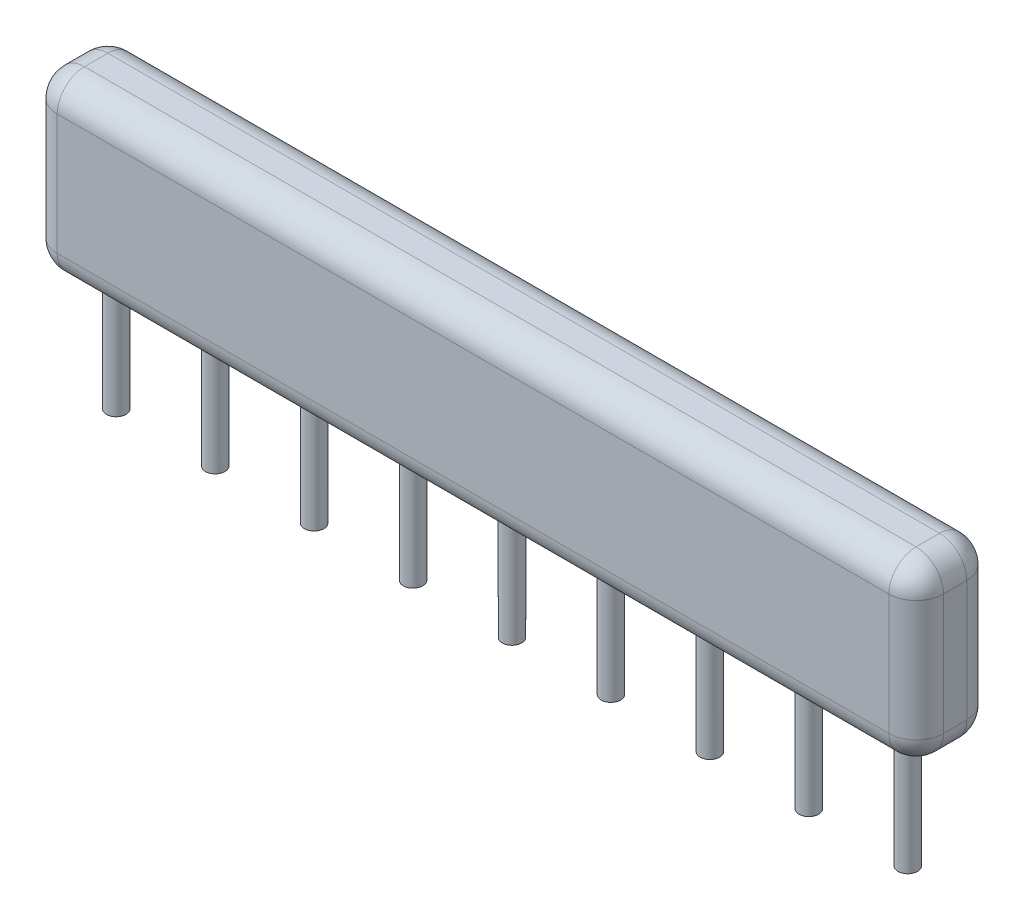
SolidWorks part; units mm, degrees
ref_plane "Plan de face" through (0, 0, 0) normal (0, 0, 1) x (1, 0, 0)
ref_plane "Plan de dessus" through (0, 0, 0) normal (0, 1, 0) x (1, 0, 0)
ref_plane "Plan de droite" through (0, 0, 0) normal (1, 0, 0) x (0, 0, -1)
sketch "Esquisse1" plane through (0, 0, 0) normal (0, 0, 1) x (1, 0, 0)
  line L0 (-5.0078, 0) -> (28.2436, 0) construction
  line L1 (0, 20.7361) -> (0, -4.1678) construction
  line L2 (22.75, 21.4002) -> (22.75, -4.1678) construction
  line L3 (-5.0078, 4.5) -> (25.5882, 4.5) construction
  line L4 (-5.0078, -4.15) -> (28.2436, -4.15) construction
  line L6 (0, 4.5) -> (22.75, 4.5)
  line L7 (0, 4.5) -> (0, 0)
  line L8 (0, 0) -> (22.75, 0)
  line L9 (22.75, 4.5) -> (22.75, 0)
  dimension "D1" = 8.65
extrude "Extrusion1" add sketch "Esquisse1" along normal blind 2
sketch "Esquisse2" plane through (0, 0, 0) normal (0, -1, 0) x (1, 0, 0)
  line L0 (-0.9998, 1) -> (24.1218, 1) construction
  line L1 (1.215, 3.8409) -> (1.215, -3.3204) construction
  line L2 (0, 2) -> (22.75, 2) construction
  circle A0 centre (1.215, 1) radius 0.25
  circle A1 centre (3.755, 1) radius 0.25
  circle A2 centre (6.295, 1) radius 0.25
  circle A3 centre (8.835, 1) radius 0.25
  circle A4 centre (11.375, 1) radius 0.25
  circle A5 centre (13.915, 1) radius 0.25
  circle A6 centre (16.455, 1) radius 0.25
  circle A7 centre (18.995, 1) radius 0.25
  circle A8 centre (21.535, 1) radius 0.25
extrude "Extrusion2" add sketch "Esquisse2" along normal blind 3
fillet "Congé1" radius 0.7 12 edges at (0, 2.25, 0) (0, 0, 1) (22.75, 0, 1) (0, 4.5, 1) (22.75, 4.5, 1) (11.375, 0, 0) (11.375, 0, 2) (11.375, 4.5, 0) (11.375, 4.5, 2) (22.75, 2.25, 0) (22.75, 2.25, 2) (0, 2.25, 2)
